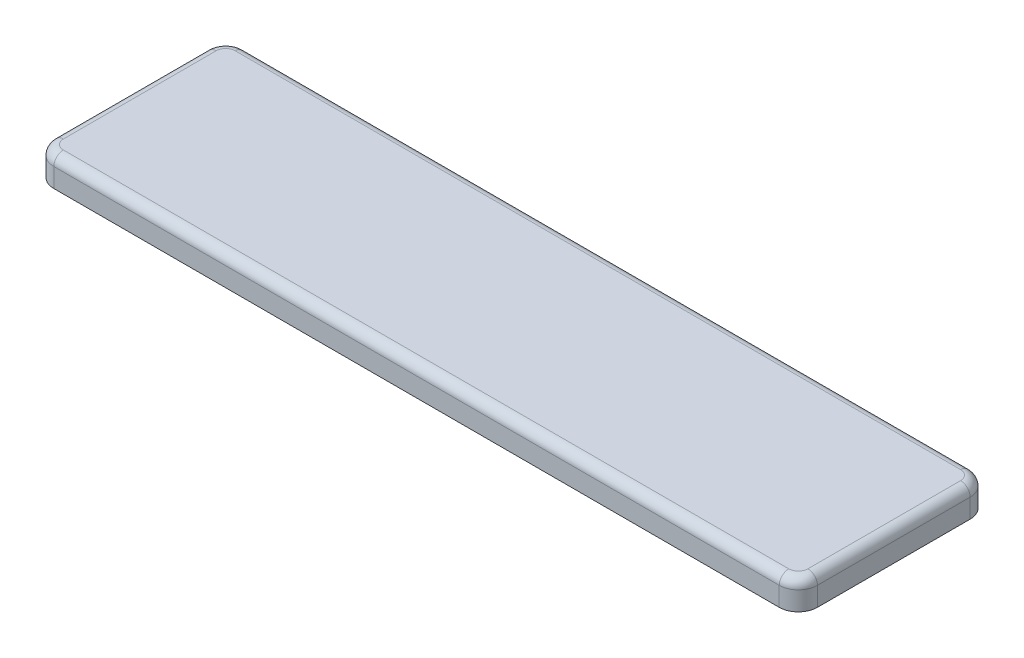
SolidWorks part; units mm, degrees
ref_plane "正面" through (0, 0, 0) normal (0, 0, 1) x (1, 0, 0)
ref_plane "平面" through (0, 0, 0) normal (0, 1, 0) x (1, 0, 0)
ref_plane "右側面" through (0, 0, 0) normal (1, 0, 0) x (0, 0, -1)
sketch "ｽｹｯﾁ1" plane through (0, 0, 0) normal (0, 1, 0) x (0, 0, -1)
  line L1 (-8, 40) -> (8, 40)
  line L2 (-10, 38) -> (-10, -38)
  line L3 (-8, -40) -> (8, -40)
  line L4 (10, 38) -> (10, -38)
  arc A0 (10, 38) -> (8, 40) centre (8, 38) ccw
  arc A1 (8, -40) -> (10, -38) centre (8, -38) ccw
  arc A2 (-10, -38) -> (-8, -40) centre (-8, -38) ccw
  arc A3 (-8, 40) -> (-10, 38) centre (-8, 38) ccw
  point P7 (10, 40)
  point P10 (10, -40)
  point P15 (-10, 40)
  dimension "D5" = 2
  dimension "D1" = 10
  dimension "D2" = 20
  dimension "D3" = 40
  dimension "D4" = 80
extrude "押し出し1" add sketch "ｽｹｯﾁ1" along normal mid plane 3
fillet "ﾌｨﾚｯﾄ1" radius 1 8 edges at (-39.4142, 1.5, 9.4142) (-40, 1.5, 0) (-39.4142, 1.5, -9.4142) (0, 1.5, -10) (39.4142, 1.5, -9.4142) (40, 1.5, 0) (39.4142, 1.5, 9.4142) (0, 1.5, 10)
sketch "ｽｹｯﾁ2" plane through (0, -1.5, 0) normal (0, -1, 0) x (1, 0, 0)
  line L1 (-38, 8.8) -> (38, 8.8)
  line L2 (-38.8, 8) -> (-38.8, -8)
  line L3 (-38, -8.8) -> (38, -8.8)
  line L4 (38.8, 8) -> (38.8, -8)
  arc A0 (-38, 8.8) -> (-38.8, 8) centre (-38, 8) ccw
  arc A1 (38.8, 8) -> (38, 8.8) centre (38, 8) ccw
  arc A2 (38, -8.8) -> (38.8, -8) centre (38, -8) ccw
  arc A3 (-38.8, -8) -> (-38, -8.8) centre (-38, -8) ccw
  point P7 (-38.8, 8.8)
  point P10 (38.8, 8.8)
  point P13 (38.8, -8.8)
  dimension "D5" = 0.8
  dimension "D1" = 38.8
  dimension "D2" = 77.6
  dimension "D3" = 8.8
  dimension "D4" = 17.6
extrude "押し出し2" cut sketch "ｽｹｯﾁ2" against normal blind 1
sketch "ｽｹｯﾁ4" plane through (0, -0.5, 0) normal (0, -1, 0) x (1, 0, 0)
  line L0 (-40, -8) -> (-40, 8) construction
  line L1 (-31.35, 2.1) -> (-28.65, 2.1)
  line L2 (-31.35, 2.1) -> (-31.35, -2.1)
  line L3 (-31.35, -2.1) -> (-28.65, -2.1)
  line L4 (-28.65, 2.1) -> (-28.65, -2.1)
  line L6 (-11.35, 2.1) -> (-8.65, 2.1)
  line L7 (-11.35, 2.1) -> (-11.35, -2.1)
  line L8 (-11.35, -2.1) -> (-8.65, -2.1)
  line L9 (-8.65, 2.1) -> (-8.65, -2.1)
  line L10 (8.65, 2.1) -> (11.35, 2.1)
  line L11 (8.65, 2.1) -> (8.65, -2.1)
  line L12 (8.65, -2.1) -> (11.35, -2.1)
  line L13 (11.35, 2.1) -> (11.35, -2.1)
  line L14 (28.65, 2.1) -> (31.35, 2.1)
  line L15 (28.65, 2.1) -> (28.65, -2.1)
  line L16 (28.65, -2.1) -> (31.35, -2.1)
  line L17 (31.35, 2.1) -> (31.35, -2.1)
  dimension "D1" = 2.7
  dimension "D2" = 4.2
  dimension "D3" = 2.1
  dimension "D4" = 8.65
  dimension "D5" = 2.7
  dimension "D6" = 2.7
  dimension "D7" = 2.7
  dimension "D8" = 17.3
  dimension "D9" = 17.3
  dimension "D10" = 17.3
extrude "押し出し4" add sketch "ｽｹｯﾁ4" along normal blind 7
fillet "ﾌｨﾚｯﾄ2" radius 1 16 edges at (-30, -7.5, 2.1) (-28.65, -7.5, 0) (-30, -7.5, -2.1) (-31.35, -7.5, 0) (30, -7.5, 2.1) (31.35, -7.5, 0) (30, -7.5, -2.1) (28.65, -7.5, 0) (10, -7.5, 2.1) (11.35, -7.5, 0) (10, -7.5, -2.1) (8.65, -7.5, 0) (-10, -7.5, 2.1) (-8.65, -7.5, 0) (-10, -7.5, -2.1) (-11.35, -7.5, 0)
